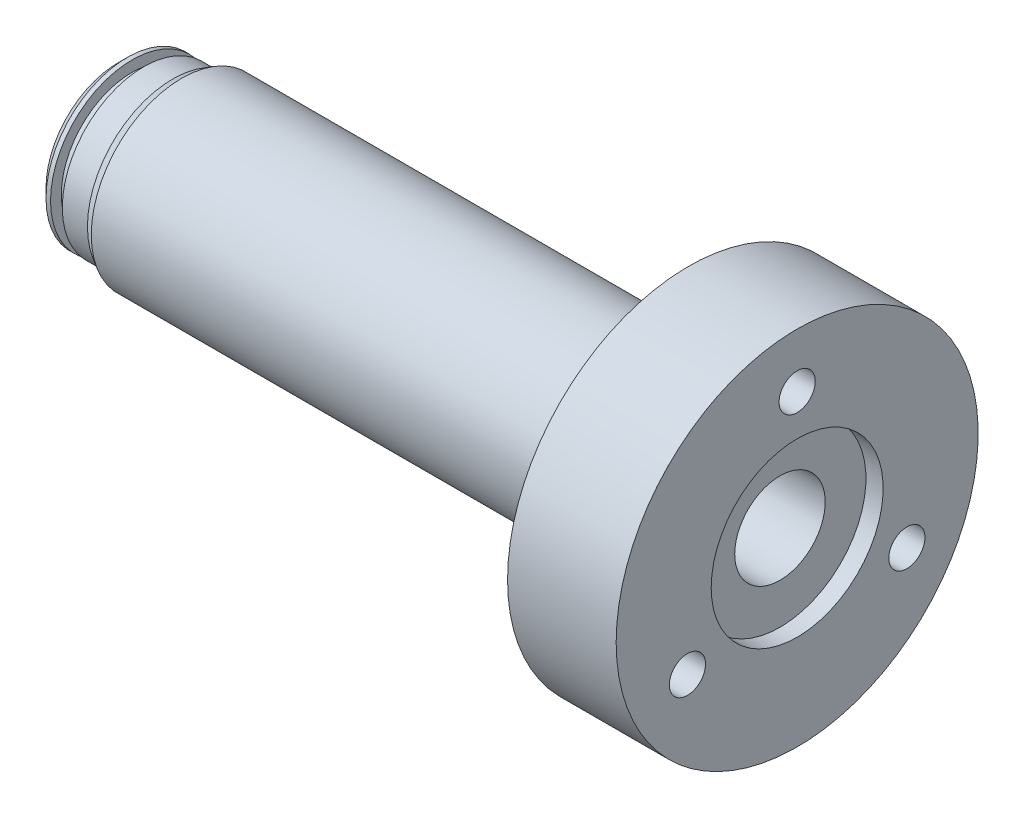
SolidWorks part; units mm, degrees
ref_plane "Face" through (0, 0, 0) normal (0, 0, 1) x (1, 0, 0)
ref_plane "Dessus" through (0, 0, 0) normal (0, 1, 0) x (1, 0, 0)
ref_plane "Droite" through (0, 0, 0) normal (1, 0, 0) x (0, 0, -1)
sketch "Esquisse1" plane through (0, 0, 0) normal (0, 0, 1) x (1, 0, 0)
  line L0 (0, 0) -> (85.3842, 0) construction
  line L1 (0, 5) -> (0, 8)
  line L2 (1, 9) -> (1.5, 9)
  line L3 (6, 9) -> (6, 9.4226)
  line L4 (7, 10) -> (56, 10)
  line L5 (58, 10) -> (58, 12.5)
  line L6 (58, 12.5) -> (63, 12.5)
  line L7 (63, 12.5) -> (63, 20)
  line L8 (63, 20) -> (75, 20)
  line L9 (75, 20) -> (75, 9.5)
  line L10 (73.1, 5) -> (0, 5)
  line L11 (2.8, 9) -> (6, 9)
  line L12 (0, 8) -> (1, 9)
  line L13 (1.5, 9) -> (1.5, 7.8079)
  line L14 (1.5, 7.8079) -> (2.8, 7.8079)
  line L15 (2.8, 9) -> (2.8, 7.8079)
  line L16 (6, 9.4226) -> (7, 10)
  line L18 (73.1, 9.5) -> (75, 9.5)
  line L19 (73.1, 9.5) -> (73.1, 5)
  arc A0 (56, 10) -> (58, 10) centre (57, 10) ccw
  point P4 (0, 9)
  point P7 (6, 10)
  dimension "D12" = 2
  dimension "D1" = 10
  dimension "D2" = 18
  dimension "D3" = 20
  dimension "D4" = 25
  dimension "D5" = 40
  dimension "D6" = 6
  dimension "D7" = 63
  dimension "D8" = 75
  dimension "D9" = 58
  dimension "D10" = 1.3
  dimension "D11" = 56.5
  dimension "D13" = 1
  dimension "D14" = 45
  dimension "D15" = 1
  dimension "D16" = 30
  dimension "D17" = 1.9
  dimension "D18" = 19
revolve "Révolution1" add sketch "Esquisse1" angle 360 about L0
hole_wizard "Trou taraudé M5x0.81" positions "Esquisse3D1" profile "Esquisse2" tap size "M5x0.8" standard "Ansi Métrique"
sketch3d "Esquisse3D1"
  line L0 (75, 0, 0) -> (75, 14, 0) construction
  line L1 (75, 0, 0) -> (73.1, 0, 0) construction
  point P0 (75, 14, 0)
  dimension "D1" = 14
sketch "Esquisse2" plane through (75, 14, 0) normal (0, 1, 0) x (0, 0, -1)
  line L0 (0, 0) -> (0, 10.2017)
  line L1 (0, 10.2017) -> (2, 9)
  line L2 (2, 9) -> (2, 0)
  line L5 (2, 0) -> (0, 0)
  line L10 (0, 10.2017) -> (-2, 9) construction
  line L11 (0, -6.35) -> (0, 107.95) construction
  dimension "Diamètre du trou pour taraudage" = 4
  dimension "Profondeur du trou pour taraudage" = 9
  dimension "Angle de pointe" = 118
pattern_circular "Répétition circulaire1" count 3 every 120 about axis through (0, 0, 0) along (1, 0, 0) of "Trou taraudé M5x0.81"
